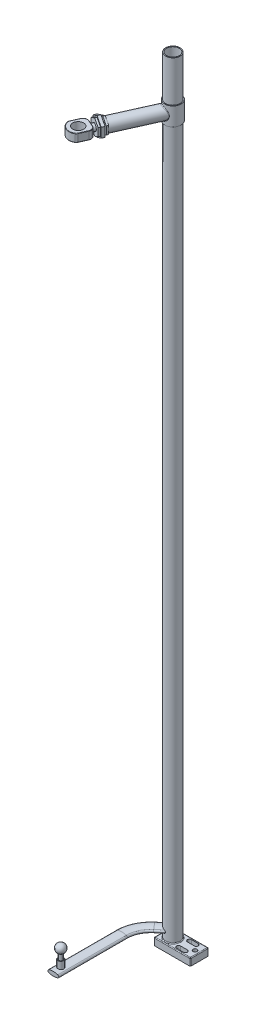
SolidWorks part; units mm, degrees
ref_plane "Front Plane" through (0, 0, 0) normal (0, 0, 1) x (1, 0, 0)
ref_plane "Top Plane" through (0, 0, 0) normal (0, 1, 0) x (1, 0, 0)
ref_plane "Right Plane" through (0, 0, 0) normal (1, 0, 0) x (0, 0, -1)
sketch "Sketch1" plane through (0, 0, 0) normal (1, 0, 0) x (0, 0, -1)
  line L0 (0, 1055.5) -> (0, -1055.5)
  point P4 (0, 0)
  dimension "D1" = 2111
ref_plane "Plane1" through (0, 1055.5, 0) normal (0, -1, 0) x (-1, 0, 0)
sketch "Sketch2" plane through (0, 1055.5, 0) normal (0, -1, 0) x (-1, 0, 0)
  circle A0 centre (0, 0) radius 20
  circle A1 centre (0, 0) radius 17.5
  dimension "D1" = 35
  dimension "D2" = 40
extrude "Boss-Extrude1" add sketch "Sketch2" along normal up to vertex
ref_plane "Plane2" through (0, 942.5, 0) normal (0, 1, 0) x (1, 0, 0)
sketch "Sketch3" plane through (0, 942.5, 0) normal (0, 1, 0) x (1, 0, 0)
  circle A0 centre (0, 0) radius 22.5
  circle A1 centre (0, 0) radius 20 construction
  circle A2 centre (0, 0) radius 20
  dimension "D1" = 45
extrude "Boss-Extrude2" add sketch "Sketch3" against normal blind 50
ref_plane "Plane3" through (0, 917.5, 0) normal (0, 1, 0) x (1, 0, 0)
sketch "Sketch4" plane through (0, 917.5, 0) normal (0, 1, 0) x (1, 0, 0)
  line L0 (0, 0) -> (-57.5783, -128.5974)
  line L1 (0, -34.0668) -> (0, 0) construction
  line L3 (0, 0) -> (-62.2553, 0) construction
  dimension "D2" = 65.88
ref_plane "Plane4" through (-57.5783, 917.5, 128.5974) normal (-0.4086, 0, 0.9127) x (0.9127, 0, 0.4086)
sketch "Sketch5" plane through (-57.5783, 917.5, 128.5974) normal (-0.4086, 0, 0.9127) x (0.9127, 0, 0.4086)
  line L0 (0, 138) -> (0, -1973) construction
  circle A0 centre (0, 0) radius 17.5
  circle A1 centre (0, 0) radius 12.5
  dimension "D1" = 35
  dimension "D2" = 25
extrude "Boss-Extrude3" add sketch "Sketch5" against normal up to vertex
other "DeleteFace1"
fillet "Fillet2" radius 2 1 edges at (-18.1767, 930.971, 13.2611)
ref_plane "Plane6" through (0, 0, 0) normal (-0.9127, 0, -0.4086) x (-0.4086, 0, 0.9127)
sketch "Sketch6" plane through (0, 0, 0) normal (0.9127, 0, 0.4086) x (0.4086, 0, -0.9127)
  line L1 (-109.5603, 929.7) -> (-140.8991, 929.7)
  line L4 (-162.8991, 926.5) -> (-162.8991, 939.2)
  line L5 (-162.8991, 939.2) -> (-157.8991, 939.2)
  line L6 (-157.8991, 939.2) -> (-157.8991, 943.5)
  line L7 (-157.8991, 943.5) -> (-149.8991, 943.5)
  line L8 (-149.8991, 943.5) -> (-149.8991, 929.7)
  line L9 (-145.8991, 929.7) -> (-145.8991, 939.2)
  line L10 (-145.8991, 939.2) -> (-140.8991, 939.2)
  line L11 (-140.8991, 939.2) -> (-140.8991, 929.7)
  line L13 (-145.8991, 929.7) -> (-149.8991, 929.7)
  line L15 (-170.8991, 926.5) -> (-170.8991, 917.5)
  line L16 (-140.8991, 994.9945) -> (-140.8991, 840.0055) construction
  line L18 (-170.8991, 917.5) -> (-109.5603, 917.5)
  line L19 (-109.5603, 929.7) -> (-109.5603, 917.5)
  line L20 (-170.8991, 926.5) -> (-162.8991, 926.5)
  line L22 (-140.8991, 917.5) -> (-44.4908, 917.5) construction
  line L23 (-140.8991, 930) -> (-140.8991, 905) construction
  dimension "D1" = 8
  dimension "D2" = 5
  dimension "D3" = 8
  dimension "D4" = 4
  dimension "D5" = 5
  dimension "D6" = 9
  dimension "D7" = 12.2
  dimension "D8" = 26
  dimension "D9" = 21.7
revolve "Revolve1" add sketch "Sketch6" angle 360 about L18
sketch "Sketch7" plane through (-66.5686, 0, 148.6766) normal (-0.4086, 0, 0.9127) x (0.9127, 0, 0.4086)
  line L0 (0, 917.5) -> (0, 939.2) construction
  line L1 (0, 1055.5) -> (0, -1055.5) construction
  line L2 (0, 917.5) -> (18.7928, 928.35) construction
  line L3 (0, 917.5) -> (18.7928, 906.65) construction
  line L4 (0, 917.5) -> (0, 895.8) construction
  line L5 (0, 917.5) -> (-18.7928, 906.65) construction
  line L6 (0, 917.5) -> (-18.7928, 928.35) construction
  line L7 (0, 939.2) -> (18.7928, 928.35)
  line L8 (18.7928, 928.35) -> (18.7928, 906.65)
  line L9 (18.7928, 906.65) -> (0, 895.8)
  line L10 (0, 895.8) -> (-18.7928, 906.65)
  line L11 (-18.7928, 906.65) -> (-18.7928, 928.35)
  line L12 (-18.7928, 928.35) -> (0, 939.2)
  circle A0 centre (0, 917.5) radius 21.7 construction
  circle A1 centre (0, 917.5) radius 21.7 construction
  point P15 (0, 917.5)
  dimension "D1" = 6
extrude "Cut-Extrude3" cut sketch "Sketch7" against normal blind 5 flip side to cut
sketch "Sketch8" plane through (-64.5253, 0, 144.1132) normal (-0.4086, 0, 0.9127) x (0.9127, 0, 0.4086)
  line L0 (0, 917.5) -> (0, 943.5) construction
  line L1 (0, 917.5) -> (22.5167, 930.5) construction
  line L2 (0, 917.5) -> (22.5167, 904.5) construction
  line L3 (0, 917.5) -> (0, 891.5) construction
  line L4 (0, 917.5) -> (-22.5167, 904.5) construction
  line L5 (0, 917.5) -> (-22.5167, 930.5) construction
  line L6 (0, 943.5) -> (22.5167, 930.5)
  line L7 (22.5167, 930.5) -> (22.5167, 904.5)
  line L8 (22.5167, 904.5) -> (0, 891.5)
  line L9 (0, 891.5) -> (-22.5167, 904.5)
  line L10 (-22.5167, 904.5) -> (-22.5167, 930.5)
  line L11 (-22.5167, 930.5) -> (0, 943.5)
  circle A0 centre (0, 917.5) radius 26 construction
  circle A1 centre (0, 917.5) radius 26 construction
  point P11 (0, 917.5)
  dimension "D1" = 6
extrude "Cut-Extrude4" cut sketch "Sketch8" against normal blind 8 flip side to cut
sketch "Sketch9" plane through (-59.6215, 0, 133.1609) normal (-0.4086, 0, 0.9127) x (0.9127, 0, 0.4086)
  line L6 (18.7928, 928.35) -> (0, 939.2)
  line L7 (18.7928, 906.65) -> (18.7928, 928.35)
  line L8 (0, 895.8) -> (18.7928, 906.65)
  line L9 (-18.7928, 906.65) -> (0, 895.8)
  line L10 (-18.7928, 928.35) -> (-18.7928, 906.65)
  line L11 (0, 939.2) -> (-18.7928, 928.35)
  line L12 (18.7928, 928.35) -> (0, 939.2)
  line L13 (18.7928, 906.65) -> (18.7928, 928.35)
  line L14 (0, 895.8) -> (18.7928, 906.65)
  line L15 (-18.7928, 906.65) -> (0, 895.8)
  line L16 (-18.7928, 928.35) -> (-18.7928, 906.65)
  line L17 (0, 939.2) -> (-18.7928, 928.35)
  dimension "D1" = 0
extrude "Cut-Extrude5" cut sketch "Sketch9" against normal blind 5 flip side to cut
sketch "Sketch10" plane through (0, 917.5, 0) normal (0, 1, 0) x (1, 0, 0)
  line L0 (-69.7475, -155.7765) -> (-91.0736, -203.407) construction
  line L1 (-49.0598, -165.0392) -> (-90.4351, -146.5138)
  line L4 (-90.4351, -146.5138) -> (-105.0365, -179.125)
  line L6 (-49.0598, -165.0392) -> (-63.6612, -197.6504)
  line L8 (-43.9745, -153.3146) -> (-64.5253, -144.1132) construction
  line L10 (0, 0) -> (-57.5783, -128.5974) construction
  circle A0 centre (-80.5901, -179.9928) radius 15
  arc A1 (-105.6959, -185.2677) -> (-67.804, -202.2334) centre (-80.5901, -179.9928) ccw
  arc A4 (-67.804, -202.2334) -> (-63.6612, -197.6504) centre (-72.7881, -193.5639) ccw
  arc A5 (-105.0365, -179.125) -> (-105.6959, -185.2677) centre (-95.9096, -183.2115) ccw
  point P12 (19.3843, -133.4378)
  dimension "D2" = 30
  dimension "D3" = 52.1868
  dimension "D4" = 45.3333
  dimension "D5" = 10
  dimension "D7" = 25.654
  dimension "D6" = 35.7308
extrude "Boss-Extrude4" add sketch "Sketch10" along normal mid plane 22 contours L0 L1 L4 A5 A1 A0 | L1 L0 A0 A1 A4 L6
chamfer "Chamfer2" distance 8 angle 45 1 edges at (-49.0598, 917.5, 165.0392)
chamfer "Chamfer4" distance 8 angle 45 1 edges at (-90.4351, 917.5, 146.5138)
fillet "Fillet10" radius 11 2 edges at (-52.329, 917.5, 172.3408) (-93.7043, 917.5, 153.8154)
fillet "Fillet11" radius 11 2 edges at (-83.1336, 917.5, 149.783) (-56.3613, 917.5, 161.7701)
fillet "Fillet12" radius 1 24 edges at (-105.8525, 906.5, 182.1441) (-100.3014, 906.5, 168.5494) (-93.0819, 906.5, 154.4741) (-88.419, 906.5, 151.7992) (-83.1592, 906.5, 150.689) (-69.7475, 906.5, 155.7765) (-57.0201, 906.5, 162.3925) (-54.3452, 906.5, 167.0554) (-53.235, 906.5, 172.3152) (-58.9261, 906.5, 187.0749) (-65.3698, 906.5, 200.2699) (-53.235, 928.5, 172.3152) (-54.3452, 928.5, 167.0554) (-57.0201, 928.5, 162.3925) (-69.7475, 928.5, 155.7765) (-83.1592, 928.5, 150.689) (-88.419, 928.5, 151.7992) (-93.0819, 928.5, 154.4741) (-100.3014, 928.5, 168.5494) (-105.8525, 928.5, 182.1441) (-91.0736, 928.5, 203.407) (-65.3698, 928.5, 200.2699) (-91.0736, 906.5, 203.407) (-58.9261, 928.5, 187.0749)
ref_plane "Plane5" through (0, -1055.5, 0) normal (0, -1, 0) x (-1, 0, 0)
sketch "Sketch14" plane through (0, -1055.5, 0) normal (0, -1, 0) x (-1, 0, 0)
  line L0 (22, 0) -> (-73, 0) construction
  line L1 (27, -25) -> (-73, -25)
  line L2 (27, -25) -> (27, 25)
  line L3 (27, 25) -> (-73, 25)
  line L4 (-73, -25) -> (-73, 25)
  line L5 (-49.5, 15) -> (-30.5, 15) construction
  line L6 (-49.5, 20.5) -> (-30.5, 20.5)
  line L7 (-49.5, 9.5) -> (-30.5, 9.5)
  line L8 (-49.5, -15) -> (-30.5, -15) construction
  line L9 (-49.5, -20.5) -> (-30.5, -20.5)
  line L10 (-49.5, -9.5) -> (-30.5, -9.5)
  line L11 (27, -25) -> (-73, -25)
  line L12 (27, 25) -> (-73, 25)
  arc A0 (-49.5, 20.5) -> (-49.5, 9.5) centre (-49.5, 15) ccw
  arc A1 (-30.5, 9.5) -> (-30.5, 20.5) centre (-30.5, 15) ccw
  arc A2 (-49.5, -20.5) -> (-49.5, -9.5) centre (-49.5, -15) cw
  arc A3 (-30.5, -9.5) -> (-30.5, -20.5) centre (-30.5, -15) cw
  circle A4 centre (-61, 0) radius 5.5
  point P10 (-40, 15)
  point P15 (-55, 15)
  point P16 (-25, 15)
  point P19 (-40, -15)
  dimension "D6" = 30
  dimension "D8" = 11
  dimension "D10" = 73
  dimension "D1" = 50
  dimension "D3" = 27
  dimension "D4" = 15
  dimension "D5" = 11
  dimension "D7" = 40
  dimension "D9" = 12
extrude "Boss-Extrude5" add sketch "Sketch14" along normal blind 20 separate body contours L4 L1 L2 L3 A4 A1 L7 A0 L6 L10 A3 L9 A2
combine bodies "Combine1" operation type add bodies to combine 112 105
fillet "Fillet13" radius 2 1 edges at (0, -1055.5, -20)
fillet "Fillet14" radius 0.8 1 edges at (-61.5333, 917.5, 159.4544)
ref_plane "Plane7" through (0, -1033.5, 0) normal (0, 1, 0) x (1, 0, 0)
sketch "Sketch21" plane through (0, -1033.5, 0) normal (0, 1, 0) x (1, 0, 0)
  line L0 (-56.0901, -84.5) -> (-56.0901, -272.9289)
  line L1 (0, 0) -> (-27.6821, -23.3586)
  arc A0 (-27.6821, -23.3586) -> (-56.0901, -84.5) centre (23.9099, -84.5) ccw
  dimension "D1" = 80
ref_plane "Plane8" through (-56.0901, -1033.5, 272.9289) normal (0, 0, 1) x (1, 0, 0)
sketch "Sketch22" plane through (-56.0901, -1033.5, 272.9289) normal (0, 0, 1) x (1, 0, 0)
  line L0 (-10.8865, 0) -> (11.1135, 0) construction
  line L1 (28.4079, 0) -> (0, 0) construction
  arc A0 (-12.077, 3.8187) -> (-12.077, -3.8187) centre (-10.8865, 0) ccw
  arc A1 (12.304, -3.8187) -> (12.304, 3.8187) centre (11.1135, 0) ccw
  arc A2 (-12.077, 3.8187) -> (12.304, 3.8187) centre (0.1135, -35.285) cw
  arc A3 (-12.077, -3.8187) -> (12.304, -3.8187) centre (0.1135, 35.285) ccw
  point P4 (0.1135, 0)
  point P9 (-14.8865, 0)
  point P10 (15.1135, 0)
  dimension "D1" = 30
sweep "Sweep1" add profiles "Sketch22" path "Sketch21"
sketch "Sketch23" plane through (0, 1055.5, 0) normal (0, 1, 0) x (1, 0, 0)
  circle A0 centre (0, 0) radius 17.5 construction
  circle A1 centre (0, 0) radius 17.5
extrude "Cut-Extrude6" cut sketch "Sketch23" against normal up to surface (2111 mm away)
sketch "Sketch24" plane through (0, -1033.5, 0) normal (0, 1, 0) x (1, 0, 0)
  circle A0 centre (-56.0901, -252.4928) radius 8
  circle A1 centre (-56.0901, -252.4928) radius 6
  dimension "D1" = 16
  dimension "D2" = 12
extrude "Boss-Extrude8" add sketch "Sketch24" along normal blind 25
sketch "Sketch25" plane through (0, -1008.5, 0) normal (0, 1, 0) x (1, 0, 0)
  line L0 (-56.0901, -244.4928) -> (-56.0901, -260.4928) construction
  circle A0 centre (-56.0901, -252.4928) radius 8 construction
  circle A1 centre (-56.0901, -252.4928) radius 8 construction
ref_plane "Plane9" through (-56.0901, 0, 0) normal (-1, 0, 0) x (0, 0, 1)
sketch "Sketch26" plane through (-56.0901, 0, 0) normal (-1, 0, 0) x (0, 0, 1)
  line L0 (252.4928, -970.4117) -> (252.4928, -1022.0798) construction
  line L1 (246.4928, -1008.5) -> (246.4928, -1027.8253) construction
  line L2 (247.4928, -1011.7268) -> (247.4928, -993.5)
  line L3 (244.4928, -1008.5) -> (260.4928, -1008.5) construction
  line L4 (258.4928, -1027.8253) -> (258.4928, -1008.5) construction
  line L7 (247.4928, -1011.7268) -> (252.4928, -1011.7268)
  line L8 (252.4928, -1011.7268) -> (252.4928, -970.4117)
  arc A0 (247.4928, -993.5) -> (252.4928, -970.4117) centre (252.062, -982.4039) cw
  point P3 (252.4928, -1008.5)
  dimension "D3" = 12
  dimension "D1" = 15
  dimension "D2" = 5
revolve "Revolve2" add sketch "Sketch26" angle 360 about L0
fillet "Fillet15" radius 2 4 edges at (-27, -1065.5, -25) (-27, -1065.5, 25) (73, -1065.5, -25) (73, -1065.5, 25)
fillet "Fillet17" radius 2 8 edges at (72.4142, -1055.5, 24.4142) (23, -1055.5, 25) (-26.4142, -1055.5, 24.4142) (-27, -1055.5, 0) (-26.4142, -1055.5, -24.4142) (23, -1055.5, -25) (72.4142, -1055.5, -24.4142) (73, -1055.5, 0)
